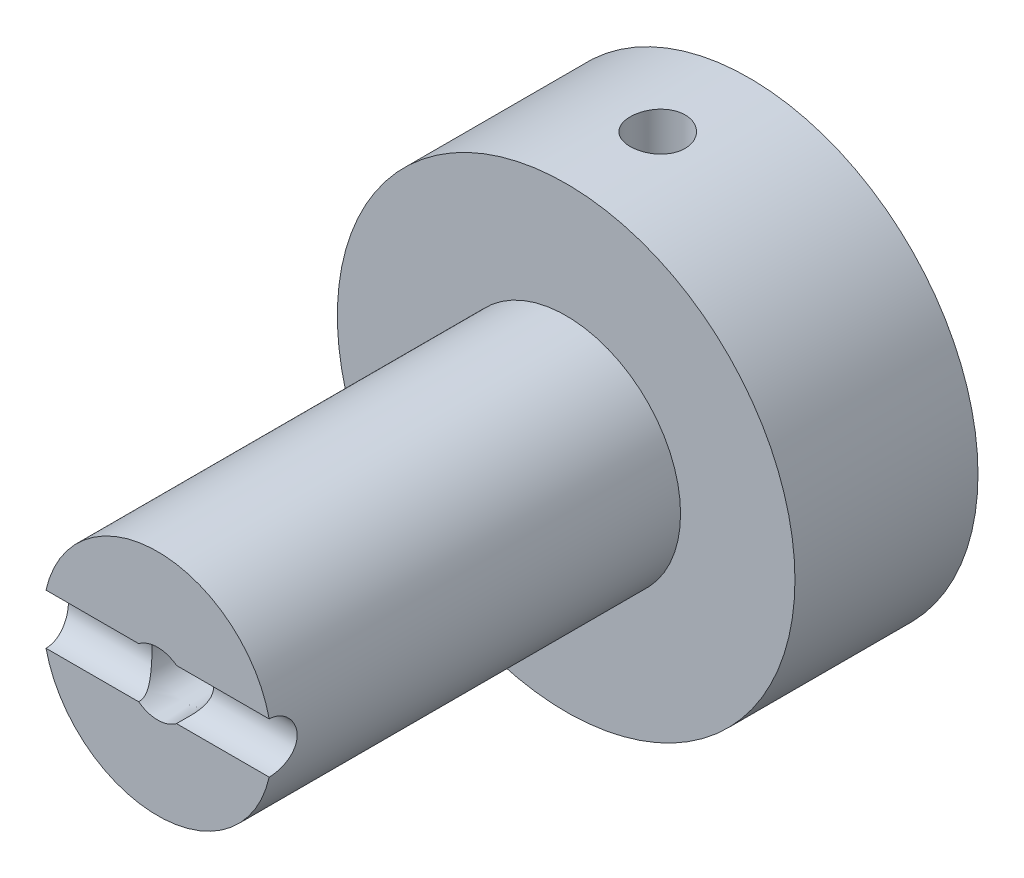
SolidWorks part; units mm, degrees
ref_plane "Face" through (0, 0, 0) normal (0, 0, 1) x (1, 0, 0)
ref_plane "Dessus" through (0, 0, 0) normal (0, 1, 0) x (1, 0, 0)
ref_plane "Droite" through (0, 0, 0) normal (1, 0, 0) x (0, 0, -1)
sketch "Esquisse1" plane through (0, 0, 0) normal (0, 0, 1) x (1, 0, 0)
  circle A0 centre (0, 0) radius 25
  dimension "D1" = 50
extrude "Extrusion1" add sketch "Esquisse1" along normal blind 20
sketch "Esquisse2" plane through (0, 0, 20) normal (0, 0, 1) x (1, 0, 0)
  circle A0 centre (0, 0) radius 12.5
  dimension "D1" = 25
extrude "Extrusion2" add sketch "Esquisse2" along normal blind 44.64
sketch "Esquisse3" plane through (0, 0, 0) normal (0, 0, -1) x (-1, 0, 0)
  circle A0 centre (0, 0) radius 1.75
  dimension "D1" = 3.5
extrude "Enlèv. mat.-Extru.1" cut sketch "Esquisse3" against normal through all draft 1.5
sketch "Esquisse4" plane through (0, 0, 0) normal (1, 0, 0) x (0, 0, -1)
  line L0 (-64.64, 12.5) -> (-64.64, -12.5) construction
  line L1 (-67.5976, 0) -> (-32.4738, 0) construction
  line L2 (-64.64, 2.75) -> (-64.64, -2.75)
  arc A0 (-64.64, 2.75) -> (-64.64, -2.75) centre (-64.64, 0) cw
  dimension "D1" = 2.75
extrude "Enlèv. mat.-Extru.2" cut sketch "Esquisse4" against normal up to next and the other way up to next
sketch "Esquisse5" plane through (0, 0, 0) normal (1, 0, 0) x (0, 0, -1)
  line L0 (-10, 25) -> (-10, 15.4226) construction
  line L1 (0, 25) -> (-20, 25) construction
  line L2 (-10, 25) -> (-7, 25)
  line L3 (-7, 25) -> (-7, 15)
  line L4 (-7, 15) -> (-10, 12)
  line L5 (-10, 12) -> (-10, 25)
  dimension "D1" = 3
  dimension "D2" = 10
  dimension "D3" = 45
revolve "Enlèvement de matière-Révolution1" cut sketch "Esquisse5" angle 360 about L0
